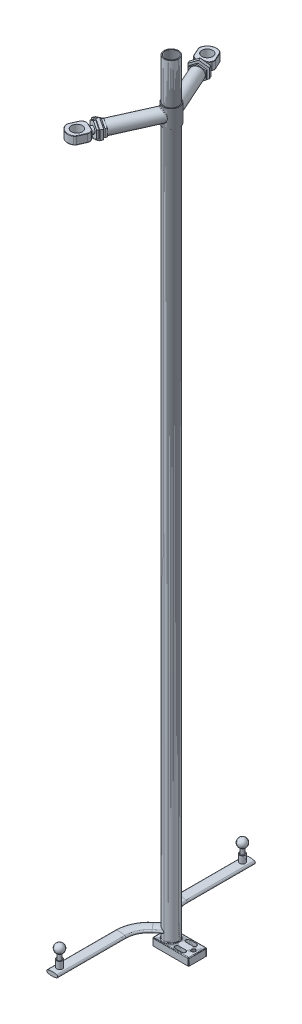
SolidWorks part; units mm, degrees
ref_plane "Front Plane" through (0, 0, 0) normal (0, 0, 1) x (1, 0, 0)
ref_plane "Top Plane" through (0, 0, 0) normal (0, 1, 0) x (1, 0, 0)
ref_plane "Right Plane" through (0, 0, 0) normal (1, 0, 0) x (0, 0, -1)
sketch "Sketch1" plane through (0, 0, 0) normal (1, 0, 0) x (0, 0, -1)
  line L0 (0, 1055.5) -> (0, -1055.5)
  point P4 (0, 0)
  dimension "D1" = 2111
ref_plane "Plane1" through (0, 1055.5, 0) normal (0, -1, 0) x (-1, 0, 0)
sketch "Sketch2" plane through (0, 1055.5, 0) normal (0, -1, 0) x (-1, 0, 0)
  circle A0 centre (0, 0) radius 20
  circle A1 centre (0, 0) radius 17.5
  dimension "D1" = 35
  dimension "D2" = 40
extrude "Boss-Extrude1" add sketch "Sketch2" along normal up to vertex
ref_plane "Plane2" through (0, 942.5, 0) normal (0, 1, 0) x (1, 0, 0)
sketch "Sketch3" plane through (0, 942.5, 0) normal (0, 1, 0) x (1, 0, 0)
  circle A0 centre (0, 0) radius 22.5
  circle A1 centre (0, 0) radius 20 construction
  circle A2 centre (0, 0) radius 20
  dimension "D1" = 45
extrude "Boss-Extrude2" add sketch "Sketch3" against normal blind 50
ref_plane "Plane3" through (0, 917.5, 0) normal (0, 1, 0) x (1, 0, 0)
sketch "Sketch4" plane through (0, 917.5, 0) normal (0, 1, 0) x (1, 0, 0)
  line L0 (0, 0) -> (-57.5783, -128.5974)
  line L1 (0, -34.0668) -> (0, 0) construction
  line L3 (0, 0) -> (-62.2553, 0) construction
  dimension "D2" = 65.88
ref_plane "Plane4" through (-57.5783, 917.5, 128.5974) normal (-0.4086, 0, 0.9127) x (0.9127, 0, 0.4086)
sketch "Sketch5" plane through (-57.5783, 917.5, 128.5974) normal (-0.4086, 0, 0.9127) x (0.9127, 0, 0.4086)
  line L0 (0, 138) -> (0, -1973) construction
  circle A0 centre (0, 0) radius 17.5
  circle A1 centre (0, 0) radius 12.5
  dimension "D1" = 35
  dimension "D2" = 25
extrude "Boss-Extrude3" add sketch "Sketch5" against normal up to vertex
other "DeleteFace1"
fillet "Fillet2" radius 2 1 edges at (-18.1767, 930.971, 13.2611)
ref_plane "Plane6" through (0, 0, 0) normal (-0.9127, 0, -0.4086) x (-0.4086, 0, 0.9127)
sketch "Sketch6" plane through (0, 0, 0) normal (0.9127, 0, 0.4086) x (0.4086, 0, -0.9127)
  line L1 (-109.5603, 929.7) -> (-140.8991, 929.7)
  line L4 (-162.8991, 926.5) -> (-162.8991, 939.2)
  line L5 (-162.8991, 939.2) -> (-157.8991, 939.2)
  line L6 (-157.8991, 939.2) -> (-157.8991, 943.5)
  line L7 (-157.8991, 943.5) -> (-149.8991, 943.5)
  line L8 (-149.8991, 943.5) -> (-149.8991, 929.7)
  line L9 (-145.8991, 929.7) -> (-145.8991, 939.2)
  line L10 (-145.8991, 939.2) -> (-140.8991, 939.2)
  line L11 (-140.8991, 939.2) -> (-140.8991, 929.7)
  line L13 (-145.8991, 929.7) -> (-149.8991, 929.7)
  line L15 (-170.8991, 926.5) -> (-170.8991, 917.5)
  line L16 (-140.8991, 994.9945) -> (-140.8991, 840.0055) construction
  line L18 (-170.8991, 917.5) -> (-109.5603, 917.5)
  line L19 (-109.5603, 929.7) -> (-109.5603, 917.5)
  line L20 (-170.8991, 926.5) -> (-162.8991, 926.5)
  line L22 (-140.8991, 917.5) -> (-44.4908, 917.5) construction
  line L23 (-140.8991, 930) -> (-140.8991, 905) construction
  dimension "D1" = 8
  dimension "D2" = 5
  dimension "D3" = 8
  dimension "D4" = 4
  dimension "D5" = 5
  dimension "D6" = 9
  dimension "D7" = 12.2
  dimension "D8" = 26
  dimension "D9" = 21.7
revolve "Revolve1" add sketch "Sketch6" angle 360 about L18
sketch "Sketch7" plane through (-66.5686, 0, 148.6766) normal (-0.4086, 0, 0.9127) x (0.9127, 0, 0.4086)
  line L0 (0, 917.5) -> (0, 939.2) construction
  line L1 (0, 1055.5) -> (0, -1055.5) construction
  line L2 (0, 917.5) -> (18.7928, 928.35) construction
  line L3 (0, 917.5) -> (18.7928, 906.65) construction
  line L4 (0, 917.5) -> (0, 895.8) construction
  line L5 (0, 917.5) -> (-18.7928, 906.65) construction
  line L6 (0, 917.5) -> (-18.7928, 928.35) construction
  line L7 (0, 939.2) -> (18.7928, 928.35)
  line L8 (18.7928, 928.35) -> (18.7928, 906.65)
  line L9 (18.7928, 906.65) -> (0, 895.8)
  line L10 (0, 895.8) -> (-18.7928, 906.65)
  line L11 (-18.7928, 906.65) -> (-18.7928, 928.35)
  line L12 (-18.7928, 928.35) -> (0, 939.2)
  circle A0 centre (0, 917.5) radius 21.7 construction
  circle A1 centre (0, 917.5) radius 21.7 construction
  point P15 (0, 917.5)
  dimension "D1" = 6
extrude "Cut-Extrude3" cut sketch "Sketch7" against normal blind 5 flip side to cut
sketch "Sketch8" plane through (-64.5253, 0, 144.1132) normal (-0.4086, 0, 0.9127) x (0.9127, 0, 0.4086)
  line L0 (0, 917.5) -> (0, 943.5) construction
  line L1 (0, 917.5) -> (22.5167, 930.5) construction
  line L2 (0, 917.5) -> (22.5167, 904.5) construction
  line L3 (0, 917.5) -> (0, 891.5) construction
  line L4 (0, 917.5) -> (-22.5167, 904.5) construction
  line L5 (0, 917.5) -> (-22.5167, 930.5) construction
  line L6 (0, 943.5) -> (22.5167, 930.5)
  line L7 (22.5167, 930.5) -> (22.5167, 904.5)
  line L8 (22.5167, 904.5) -> (0, 891.5)
  line L9 (0, 891.5) -> (-22.5167, 904.5)
  line L10 (-22.5167, 904.5) -> (-22.5167, 930.5)
  line L11 (-22.5167, 930.5) -> (0, 943.5)
  circle A0 centre (0, 917.5) radius 26 construction
  circle A1 centre (0, 917.5) radius 26 construction
  point P11 (0, 917.5)
  dimension "D1" = 6
extrude "Cut-Extrude4" cut sketch "Sketch8" against normal blind 8 flip side to cut
sketch "Sketch9" plane through (-59.6215, 0, 133.1609) normal (-0.4086, 0, 0.9127) x (0.9127, 0, 0.4086)
  line L6 (18.7928, 928.35) -> (0, 939.2)
  line L7 (18.7928, 906.65) -> (18.7928, 928.35)
  line L8 (0, 895.8) -> (18.7928, 906.65)
  line L9 (-18.7928, 906.65) -> (0, 895.8)
  line L10 (-18.7928, 928.35) -> (-18.7928, 906.65)
  line L11 (0, 939.2) -> (-18.7928, 928.35)
  line L12 (18.7928, 928.35) -> (0, 939.2)
  line L13 (18.7928, 906.65) -> (18.7928, 928.35)
  line L14 (0, 895.8) -> (18.7928, 906.65)
  line L15 (-18.7928, 906.65) -> (0, 895.8)
  line L16 (-18.7928, 928.35) -> (-18.7928, 906.65)
  line L17 (0, 939.2) -> (-18.7928, 928.35)
  dimension "D1" = 0
extrude "Cut-Extrude5" cut sketch "Sketch9" against normal blind 5 flip side to cut
sketch "Sketch10" plane through (0, 917.5, 0) normal (0, 1, 0) x (1, 0, 0)
  line L0 (-69.7475, -155.7765) -> (-91.0736, -203.407) construction
  line L1 (-49.0598, -165.0392) -> (-90.4351, -146.5138)
  line L4 (-90.4351, -146.5138) -> (-105.0365, -179.125)
  line L6 (-49.0598, -165.0392) -> (-63.6612, -197.6504)
  line L8 (-43.9745, -153.3146) -> (-64.5253, -144.1132) construction
  line L10 (0, 0) -> (-57.5783, -128.5974) construction
  circle A0 centre (-80.5901, -179.9928) radius 15
  arc A1 (-105.6959, -185.2677) -> (-67.804, -202.2334) centre (-80.5901, -179.9928) ccw
  arc A4 (-67.804, -202.2334) -> (-63.6612, -197.6504) centre (-72.7881, -193.5639) ccw
  arc A5 (-105.0365, -179.125) -> (-105.6959, -185.2677) centre (-95.9096, -183.2115) ccw
  point P12 (19.3843, -133.4378)
  dimension "D2" = 30
  dimension "D3" = 52.1868
  dimension "D4" = 45.3333
  dimension "D5" = 10
  dimension "D7" = 25.654
  dimension "D6" = 35.7308
extrude "Boss-Extrude4" add sketch "Sketch10" along normal mid plane 22 contours L0 L1 L4 A5 A1 A0 | L1 L0 A0 A1 A4 L6
chamfer "Chamfer2" distance 8 angle 45 1 edges at (-49.0598, 917.5, 165.0392)
chamfer "Chamfer4" distance 8 angle 45 1 edges at (-90.4351, 917.5, 146.5138)
fillet "Fillet10" radius 11 2 edges at (-52.329, 917.5, 172.3408) (-93.7043, 917.5, 153.8154)
fillet "Fillet11" radius 11 2 edges at (-83.1336, 917.5, 149.783) (-56.3613, 917.5, 161.7701)
fillet "Fillet12" radius 1 24 edges at (-105.8525, 906.5, 182.1441) (-100.3014, 906.5, 168.5494) (-93.0819, 906.5, 154.4741) (-88.419, 906.5, 151.7992) (-83.1592, 906.5, 150.689) (-69.7475, 906.5, 155.7765) (-57.0201, 906.5, 162.3925) (-54.3452, 906.5, 167.0554) (-53.235, 906.5, 172.3152) (-58.9261, 906.5, 187.0749) (-65.3698, 906.5, 200.2699) (-53.235, 928.5, 172.3152) (-54.3452, 928.5, 167.0554) (-57.0201, 928.5, 162.3925) (-69.7475, 928.5, 155.7765) (-83.1592, 928.5, 150.689) (-88.419, 928.5, 151.7992) (-93.0819, 928.5, 154.4741) (-100.3014, 928.5, 168.5494) (-105.8525, 928.5, 182.1441) (-91.0736, 928.5, 203.407) (-65.3698, 928.5, 200.2699) (-91.0736, 906.5, 203.407) (-58.9261, 928.5, 187.0749)
ref_plane "Plane5" through (0, -1055.5, 0) normal (0, -1, 0) x (-1, 0, 0)
sketch "Sketch14" plane through (0, -1055.5, 0) normal (0, -1, 0) x (-1, 0, 0)
  line L0 (22, 0) -> (-73, 0) construction
  line L1 (27, -25) -> (-73, -25)
  line L2 (27, -25) -> (27, 25)
  line L3 (27, 25) -> (-73, 25)
  line L4 (-73, -25) -> (-73, 25)
  line L5 (-49.5, 15) -> (-30.5, 15) construction
  line L6 (-49.5, 20.5) -> (-30.5, 20.5)
  line L7 (-49.5, 9.5) -> (-30.5, 9.5)
  line L8 (-49.5, -15) -> (-30.5, -15) construction
  line L9 (-49.5, -20.5) -> (-30.5, -20.5)
  line L10 (-49.5, -9.5) -> (-30.5, -9.5)
  line L11 (27, -25) -> (-73, -25)
  line L12 (27, 25) -> (-73, 25)
  arc A0 (-49.5, 20.5) -> (-49.5, 9.5) centre (-49.5, 15) ccw
  arc A1 (-30.5, 9.5) -> (-30.5, 20.5) centre (-30.5, 15) ccw
  arc A2 (-49.5, -20.5) -> (-49.5, -9.5) centre (-49.5, -15) cw
  arc A3 (-30.5, -9.5) -> (-30.5, -20.5) centre (-30.5, -15) cw
  circle A4 centre (-61, 0) radius 5.5
  point P10 (-40, 15)
  point P15 (-55, 15)
  point P16 (-25, 15)
  point P19 (-40, -15)
  dimension "D6" = 30
  dimension "D8" = 11
  dimension "D10" = 73
  dimension "D1" = 50
  dimension "D3" = 27
  dimension "D4" = 15
  dimension "D5" = 11
  dimension "D7" = 40
  dimension "D9" = 12
extrude "Boss-Extrude5" add sketch "Sketch14" along normal blind 20 separate body contours L4 L1 L2 L3 A4 A1 L7 A0 L6 L10 A3 L9 A2
combine bodies "Combine1" operation type add bodies to combine 112 105
fillet "Fillet13" radius 2 1 edges at (0, -1055.5, -20)
fillet "Fillet14" radius 0.8 1 edges at (-61.5333, 917.5, 159.4544)
ref_plane "Plane7" through (0, -1033.5, 0) normal (0, 1, 0) x (1, 0, 0)
sketch "Sketch21" plane through (0, -1033.5, 0) normal (0, 1, 0) x (1, 0, 0)
  line L0 (-56.0901, -84.5) -> (-56.0901, -272.9289)
  line L1 (0, 0) -> (-27.6821, -23.3586)
  arc A0 (-27.6821, -23.3586) -> (-56.0901, -84.5) centre (23.9099, -84.5) ccw
  dimension "D1" = 80
ref_plane "Plane8" through (-56.0901, -1033.5, 272.9289) normal (0, 0, 1) x (1, 0, 0)
sketch "Sketch22" plane through (-56.0901, -1033.5, 272.9289) normal (0, 0, 1) x (1, 0, 0)
  line L0 (-10.8865, 0) -> (11.1135, 0) construction
  line L1 (28.4079, 0) -> (0, 0) construction
  arc A0 (-12.077, 3.8187) -> (-12.077, -3.8187) centre (-10.8865, 0) ccw
  arc A1 (12.304, -3.8187) -> (12.304, 3.8187) centre (11.1135, 0) ccw
  arc A2 (-12.077, 3.8187) -> (12.304, 3.8187) centre (0.1135, -35.285) cw
  arc A3 (-12.077, -3.8187) -> (12.304, -3.8187) centre (0.1135, 35.285) ccw
  point P4 (0.1135, 0)
  point P9 (-14.8865, 0)
  point P10 (15.1135, 0)
  dimension "D1" = 30
sweep "Sweep1" add profiles "Sketch22" path "Sketch21"
sketch "Sketch23" plane through (0, 1055.5, 0) normal (0, 1, 0) x (1, 0, 0)
  circle A0 centre (0, 0) radius 17.5 construction
  circle A1 centre (0, 0) radius 17.5
extrude "Cut-Extrude6" cut sketch "Sketch23" against normal up to surface (2111 mm away)
sketch "Sketch24" plane through (0, -1033.5, 0) normal (0, 1, 0) x (1, 0, 0)
  circle A0 centre (-56.0901, -252.4928) radius 8
  circle A1 centre (-56.0901, -252.4928) radius 6
  dimension "D1" = 16
  dimension "D2" = 12
extrude "Boss-Extrude8" add sketch "Sketch24" along normal blind 25
sketch "Sketch25" plane through (0, -1008.5, 0) normal (0, 1, 0) x (1, 0, 0)
  line L0 (-56.0901, -244.4928) -> (-56.0901, -260.4928) construction
  circle A0 centre (-56.0901, -252.4928) radius 8 construction
  circle A1 centre (-56.0901, -252.4928) radius 8 construction
ref_plane "Plane9" through (-56.0901, 0, 0) normal (-1, 0, 0) x (0, 0, 1)
sketch "Sketch26" plane through (-56.0901, 0, 0) normal (-1, 0, 0) x (0, 0, 1)
  line L0 (252.4928, -970.4117) -> (252.4928, -1022.0798) construction
  line L1 (246.4928, -1008.5) -> (246.4928, -1027.8253) construction
  line L2 (247.4928, -1011.7268) -> (247.4928, -993.5)
  line L3 (244.4928, -1008.5) -> (260.4928, -1008.5) construction
  line L4 (258.4928, -1027.8253) -> (258.4928, -1008.5) construction
  line L7 (247.4928, -1011.7268) -> (252.4928, -1011.7268)
  line L8 (252.4928, -1011.7268) -> (252.4928, -970.4117)
  arc A0 (247.4928, -993.5) -> (252.4928, -970.4117) centre (252.062, -982.4039) cw
  point P3 (252.4928, -1008.5)
  dimension "D3" = 12
  dimension "D1" = 15
  dimension "D2" = 5
revolve "Revolve2" add sketch "Sketch26" angle 360 about L0
fillet "Fillet15" radius 2 4 edges at (-27, -1065.5, -25) (-27, -1065.5, 25) (73, -1065.5, -25) (73, -1065.5, 25)
fillet "Fillet17" radius 2 8 edges at (72.4142, -1055.5, 24.4142) (23, -1055.5, 25) (-26.4142, -1055.5, 24.4142) (-27, -1055.5, 0) (-26.4142, -1055.5, -24.4142) (23, -1055.5, -25) (72.4142, -1055.5, -24.4142) (73, -1055.5, 0)
mirror "Mirror3" about plane through (0, 0, 0) normal (0, 0, 1)
